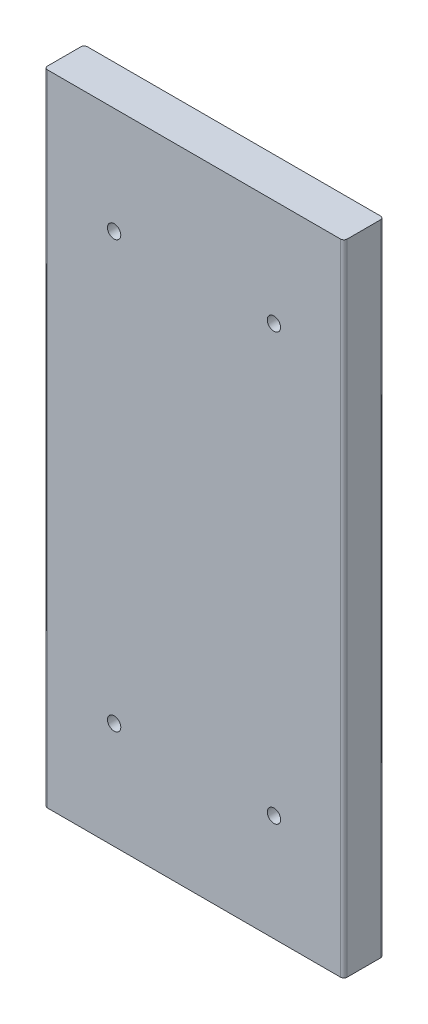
SolidWorks part; units mm, degrees
ref_plane "Front" through (0, 0, 0) normal (0, 0, 1) x (1, 0, 0)
ref_plane "Top" through (0, 0, 0) normal (0, 1, 0) x (1, 0, 0)
ref_plane "Right" through (0, 0, 0) normal (1, 0, 0) x (0, 0, -1)
sketch "Sketch1" plane through (0, 0, 0) normal (0, 0, 1) x (1, 0, 0)
  line L0 (66.675, 508) -> (66.675, 609.6) construction
  line L1 (0, 0) -> (285.75, 0)
  line L2 (0, 0) -> (0, 609.6)
  line L3 (0, 609.6) -> (285.75, 609.6)
  line L4 (285.75, 0) -> (285.75, 609.6)
  line L5 (66.675, 508) -> (66.675, 101.6) construction
  line L6 (66.675, 101.6) -> (66.675, 0) construction
  line L7 (66.675, 508) -> (219.075, 508) construction
  line L8 (219.075, 101.6) -> (66.675, 101.6) construction
  line L9 (219.075, 101.6) -> (219.075, 508) construction
  line L10 (66.675, 508) -> (0, 508) construction
  line L11 (219.075, 508) -> (285.75, 508) construction
  circle A0 centre (66.675, 508) radius 6.35
  circle A1 centre (66.675, 101.6) radius 6.35
  circle A2 centre (219.075, 508) radius 6.35
  circle A3 centre (219.075, 101.6) radius 6.35
  point P16 (0, 458.2242)
  dimension "D4" = 12.7
  dimension "D5" = 152.4
  dimension "D1" = 609.6
  dimension "D2" = 285.75
  dimension "D3" = 406.4
extrude "Boss-Extrude1" add sketch "Sketch1" along normal blind 38.1
fillet "Fillet1" radius 3.175 4 edges at (285.75, 304.8, 38.1) (0, 304.8, 38.1) (285.75, 304.8, 0) (0, 304.8, 0)
